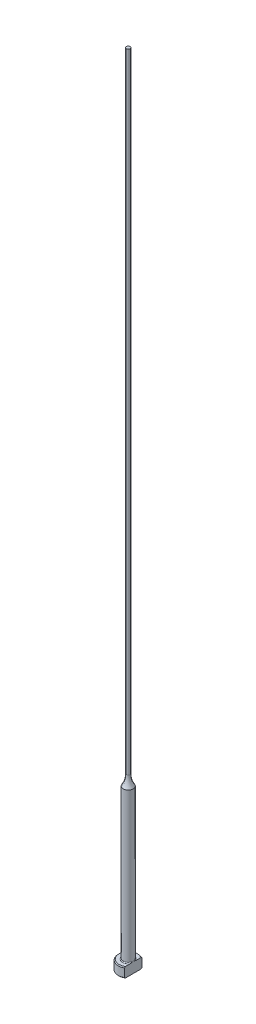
SolidWorks part; units mm, degrees
ref_plane "Front Plane" through (0, 0, 0) normal (0, 0, 1) x (1, 0, 0)
ref_plane "Top Plane" through (0, 0, 0) normal (0, 1, 0) x (1, 0, 0)
ref_plane "Right Plane" through (0, 0, 0) normal (1, 0, 0) x (0, 0, -1)
sketch "Sketch1" plane through (0, 0, 0) normal (0, 0, 1) x (1, 0, 0)
  line L0 (0, 259.9588) -> (0, -15.1925) construction
  line L1 (0, 0) -> (-3.175, 0)
  line L2 (-3.175, 0) -> (-3.175, 3.175)
  line L3 (-3.175, 3.175) -> (-1.5875, 3.175)
  line L4 (-0.5944, 54.2098) -> (-0.5944, 254)
  line L5 (-0.5944, 254) -> (0, 254)
  line L6 (0, 254) -> (0, 0)
  line L7 (-1.5875, 3.175) -> (-1.5875, 50.8)
  arc A0 (-1.5875, 50.8) -> (-0.5944, 54.2098) centre (-6.9444, 54.2098) ccw
  point P13 (-1.5875, 0)
  dimension "D1" = 6.35
  dimension "L" = 254
  dimension "D2" = 3.175
  dimension "H" = 6.35
  dimension "T" = 3.175
  dimension "D" = 1.1887
  dimension "S" = 50.8
revolve "Revolve1" add sketch "Sketch1" angle 360 about L0
chamfer "Chamfer1" distance 0.254 angle 45 2 edges at (0, 3.175, 3.175) (0, 0, 3.175)
fillet "Fillet1" radius 0.254 1 edges at (0, 3.175, 1.5875)
sketch "Sketch2" plane through (0, 0, 0) normal (0, 1, 0) x (1, 0, 0)
  line L0 (1.5875, -2.7496) -> (1.5875, 2.7496)
  circle A0 centre (0, 0) radius 3.175 construction
  arc A2 (1.5875, -2.7496) -> (1.5875, 2.7496) centre (0, 0) ccw
  circle A3 centre (0, 0) radius 3.175 construction
  circle A4 centre (0, 0) radius 1.5875 construction
extrude "Key Head" cut sketch "Sketch2" along normal up to next
